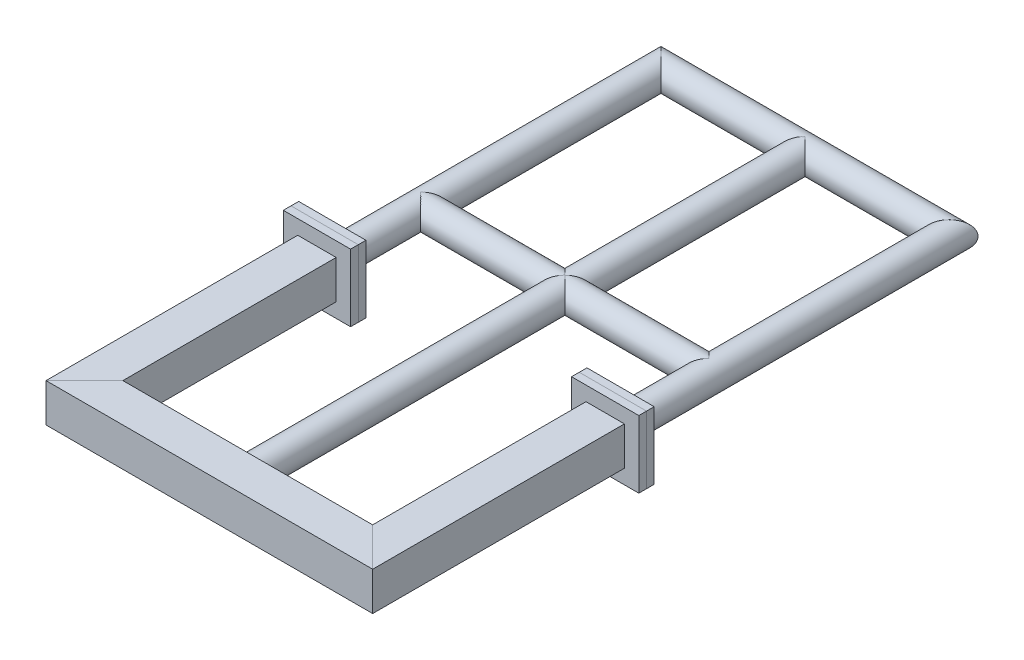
SolidWorks part; units mm, degrees
ref_plane "Front Plane" through (0, 0, 0) normal (0, 0, 1) x (1, 0, 0)
ref_plane "Top Plane" through (0, 0, 0) normal (0, 1, 0) x (1, 0, 0)
ref_plane "Right Plane" through (0, 0, 0) normal (1, 0, 0) x (0, 0, -1)
sketch "Sketch1" plane through (0, 0, 0) normal (0, 1, 0) x (1, 0, 0)
  line L0 (150, 0) -> (150, 600)
  line L1 (0, 0) -> (300, 0)
  line L2 (0, 0) -> (0, 250)
  line L3 (0, 600) -> (300, 600)
  line L4 (300, 0) -> (300, 250)
  line L5 (0, 350) -> (300, 350)
  line L6 (300, 250) -> (300, 600)
  line L7 (0, 250) -> (0, 600)
  point P9 (0, 123.3131)
  dimension "D1" = 300
  dimension "D2" = 600
  dimension "D3" = 250
  dimension "D4" = 250
  dimension "D5" = 250
other "Structural Member4"
ref_plane "Plane4" through (0, 0, -250) normal (0, 0, -1) x (-1, 0, 0)
sketch "Sketch15" plane through (0, 0, -250) normal (0, 0, -1) x (-1, 0, 0)
  circle A0 centre (0, 0) radius 10
  circle A1 centre (0, 0) radius 15
  point P4 (0, 0)
  dimension "D1" = 5
  dimension "D2" = 30
other "Structural Member5"
ref_plane "Plane5" through (150, 0, 0) normal (0, 0, -1) x (-1, 0, 0)
sketch "Sketch16" plane through (150, 0, 0) normal (0, 0, -1) x (-1, 0, 0)
  circle A0 centre (0, 0) radius 10
  circle A1 centre (0, 0) radius 15
  point P4 (0, 0)
  dimension "D1" = 5
  dimension "D2" = 30
other "Trim/Extend4"
other "Trim/Extend5"
other "Structural Member6"
ref_plane "Plane6" through (0, 0, 0) normal (0, 0, -1) x (-1, 0, 0)
sketch "Sketch17" plane through (0, 0, 0) normal (0, 0, -1) x (-1, 0, 0)
  line L1 (-17, 17) -> (17, 17)
  line L2 (-17, 17) -> (-17, -17)
  line L3 (-17, -17) -> (17, -17)
  line L4 (17, 17) -> (17, -17)
  line L5 (-17, 17) -> (17, -17) construction
  line L6 (-17, -17) -> (17, 17) construction
  line L7 (-20, 20) -> (20, 20)
  line L8 (-20, 20) -> (-20, -20)
  line L9 (-20, -20) -> (20, -20)
  line L10 (20, 20) -> (20, -20)
  line L11 (-20, 20) -> (20, -20) construction
  line L12 (-20, -20) -> (20, 20) construction
  point P0 (0, 0)
  point P6 (0, 0)
  point P11 (0, 17)
  point P12 (0, 20)
  point P13 (-17, 0)
  point P14 (-20, 0)
  point P15 (17, 0)
  point P16 (20, 0)
  point P17 (0, -20)
  point P18 (0, -17)
  point P19 (0, 0)
  dimension "D1" = 3
  dimension "D4" = 40
  dimension "D2" = 3
  dimension "D3" = 40
other "Trim/Extend6"
sketch "Sketch18" plane through (0, 0, -250) normal (0, 0, -1) x (-1, 0, 0)
  line L1 (35, 35) -> (-35, 35)
  line L2 (35, 35) -> (35, -35)
  line L3 (35, -35) -> (-35, -35)
  line L4 (-35, 35) -> (-35, -35)
  line L5 (35, 35) -> (-35, -35) construction
  line L6 (35, -35) -> (-35, 35) construction
  point P0 (0, 0)
  dimension "D1" = 70
  dimension "D2" = 70
extrude "Boss-Extrude1" add sketch "Sketch18" against normal blind 8 separate body
sketch "Sketch19" plane through (0, 0, -250) normal (0, 0, -1) x (-1, 0, 0)
  line L4 (-35, 35) -> (-35, -35)
  line L5 (-35, -35) -> (35, -35)
  line L6 (35, -35) -> (35, 35)
  line L7 (35, 35) -> (-35, 35)
  line L8 (-35, 35) -> (-35, -35)
  line L9 (-35, -35) -> (35, -35)
  line L10 (35, -35) -> (35, 35)
  line L11 (35, 35) -> (-35, 35)
  dimension "D1" = 0
extrude "Boss-Extrude2" add sketch "Sketch19" along normal blind 8 separate body
pattern_circular "CirPattern1" count 2 over 360 about axis through (150, 0, 0) along (0, 0, 1)
other "Trim/Extend7"
other "Trim/Extend8"
